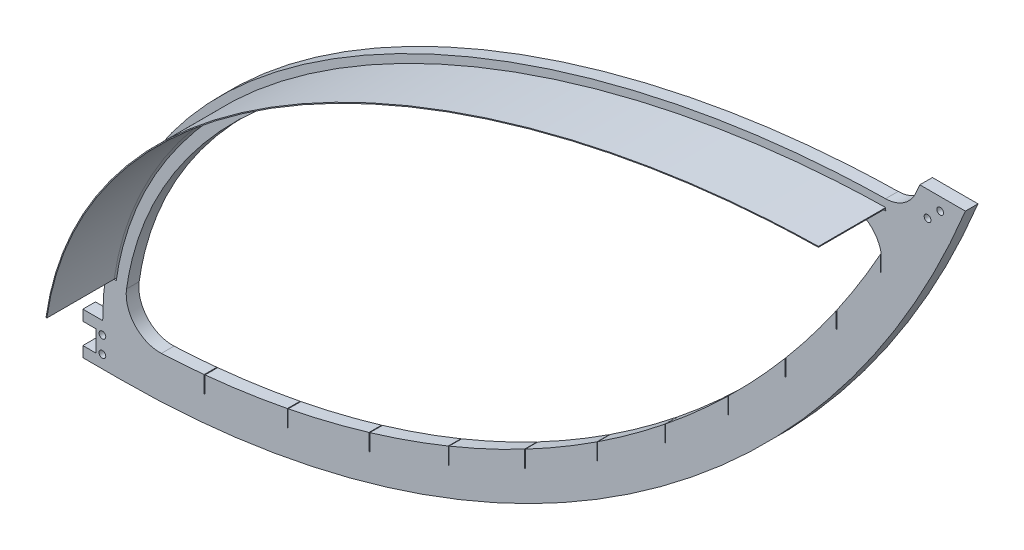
SolidWorks part; units mm, degrees
other "<Cage_wood_cuved_V02>-<Extrude-Thin1>"
other "<Cage_wood_cuved_V02>-<DeleteFace1>"
ref_plane "Ebene vorne" through (0, 0, 0) normal (0, 0, 1) x (1, 0, 0)
ref_plane "Ebene oben" through (0, 0, 0) normal (0, 1, 0) x (1, 0, 0)
ref_plane "Ebene rechts" through (0, 0, 0) normal (1, 0, 0) x (0, 0, -1)
mirrored part "Cage_wood_cuved_V02_Mirrored"
